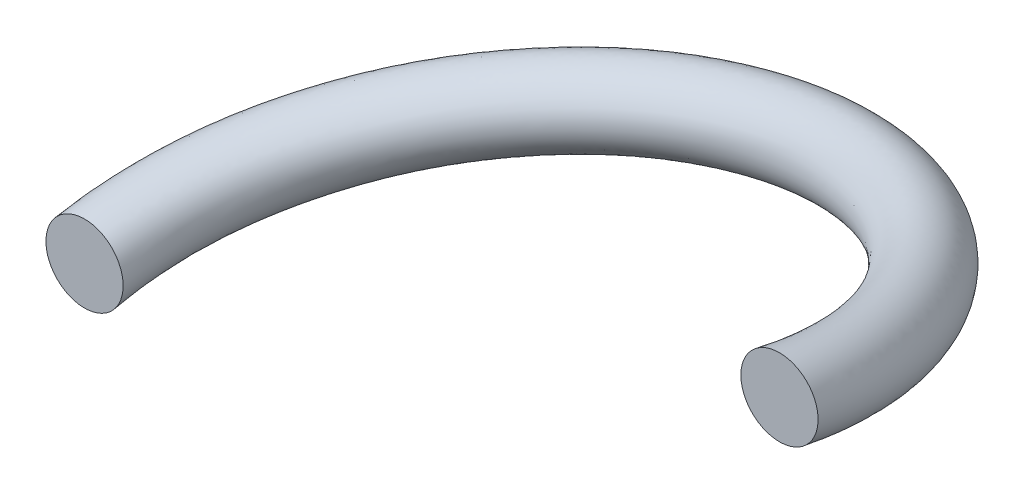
SolidWorks part; units mm, degrees
ref_plane "Ön Düzlem" through (0, 0, 0) normal (0, 0, 1) x (1, 0, 0)
ref_plane "Üst Düzlem" through (0, 0, 0) normal (0, 1, 0) x (1, 0, 0)
ref_plane "Sağ Düzlem" through (0, 0, 0) normal (1, 0, 0) x (0, 0, -1)
sketch "Çizim1" plane through (0, 0, 0) normal (0, 0, 1) x (1, 0, 0)
  line L0 (0, 0) -> (0, 30)
  dimension "D1" = 30
sketch "Çizim3" plane through (0, 0, 0) normal (0, 0, 1) x (1, 0, 0)
  line L0 (0, 0) -> (0, 30) construction
  circle A0 centre (-45, 5) radius 5
  dimension "D1" = 10
  dimension "D2" = 45
  dimension "D3" = 5
sweep "Süpür1" add profiles "Çizim3" path "Çizim1" parameters "D1"=180
sketch "Çizim4" plane through (0, 0, 0) normal (0, 0, 1) x (1, 0, 0)
  point P0 (45, 35)
sketch "Çizim5" plane through (0, 0, 0) normal (0, 0, 1) x (1, 0, 0)
  point P0 (-45, 5)
sketch "Çizim8" plane through (0, 0, 0) normal (0, 0, 1) x (1, 0, 0)
  line L0 (-45, 10) -> (45, 30)
  circle A0 centre (-45, 5) radius 5 construction
  circle A1 centre (45, 35) radius 5 construction
